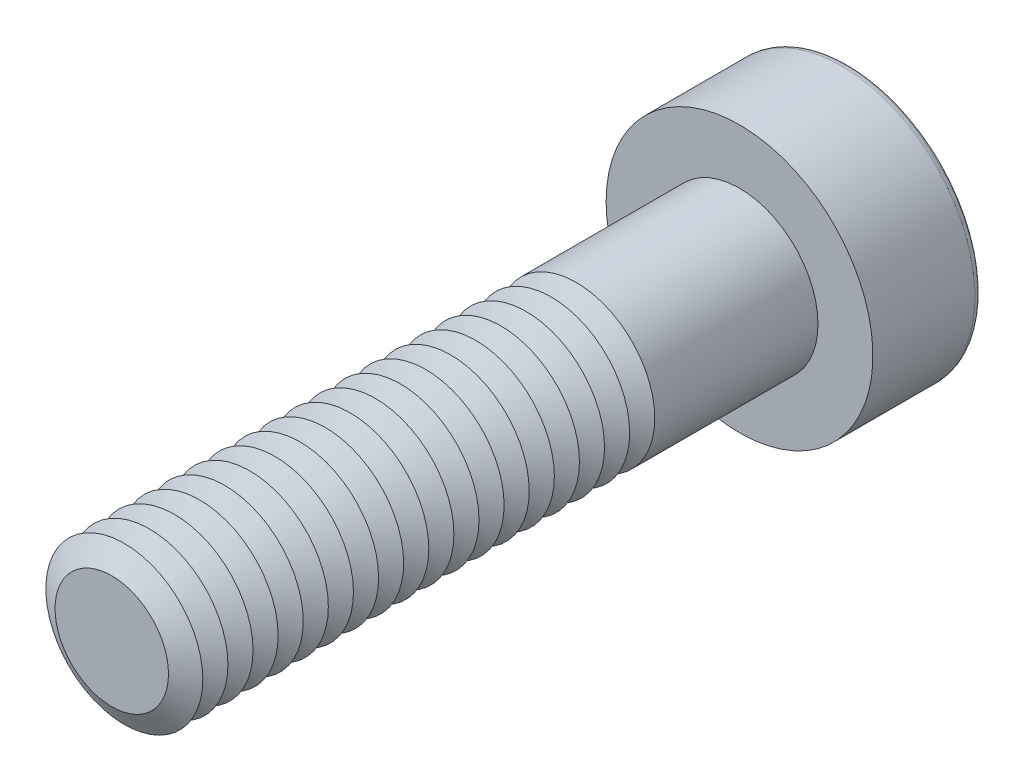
SolidWorks part; units mm, degrees
ref_plane "Front Plane" through (0, 0, 0) normal (0, 0, 1) x (1, 0, 0)
ref_plane "Top Plane" through (0, 0, 0) normal (0, 1, 0) x (1, 0, 0)
ref_plane "Right Plane" through (0, 0, 0) normal (1, 0, 0) x (0, 0, -1)
sketch "Sketch1" plane through (0, 0, 0) normal (0, 0, 1) x (1, 0, 0)
  circle A0 centre (0, 0) radius 2.5
  dimension "D1" = 5
extrude "Boss-Extrude1" add sketch "Sketch1" along normal blind 20
sketch "Sketch2" plane through (0, 0, 0) normal (0, 0, -1) x (-1, 0, 0)
  circle A0 centre (0, 0) radius 4.25
  dimension "D1" = 8.5
extrude "Boss-Extrude2" add sketch "Sketch2" along normal blind 3.5
sketch "Sketch3" plane through (0, 0, -3.5) normal (0, 0, -1) x (-1, 0, 0)
  line L1 (-0.866, 1.5) -> (-1.7321, 0)
  line L2 (-1.7321, 0) -> (-0.866, -1.5)
  line L3 (-0.866, -1.5) -> (0.866, -1.5)
  line L4 (0.866, -1.5) -> (1.7321, 0)
  line L5 (1.7321, 0) -> (0.866, 1.5)
  line L6 (0.866, 1.5) -> (-0.866, 1.5)
  circle A0 centre (0, 0) radius 1.5 construction
  dimension "D1" = 3
extrude "Cut-Extrude1" cut sketch "Sketch3" against normal blind 2.25
fillet "Fillet1" radius 0.25 1 edges at (-4.25, 0, -3.5)
sketch "Sketch4" plane through (0, 0, -1.25) normal (0, 0, -1) x (-1, 0, 0)
  line L0 (0.866, -1.5) -> (1.7321, 0) construction
  circle A0 centre (0, 0) radius 1.5
extrude "Cut-Extrude2" cut sketch "Sketch4" against normal through all draft 60
sketch "Sketch5" plane through (0, 0, -3.5) normal (0, 0, -1) x (-1, 0, 0)
  circle A0 centre (0, 0) radius 1.7321
extrude "Cut-Extrude3" cut sketch "Sketch5" against normal through all draft 75
sketch "Sketch7" plane through (0, 0, 0) normal (1, 0, 0) x (0, 0, -1)
  line L25 (-20, 1.8072) -> (-19.6, 2.5)
  line L26 (-20, 2.5) -> (-20, -2.5) construction
  line L27 (-19.6, 2.5) -> (-20.4, 2.5)
  line L28 (-20.4, 2.5) -> (-20, 1.8072)
  line L29 (0, 2.5) -> (-20, 2.5) construction
  dimension "D1" = 0.8
revolve "Cut-Revolve1" cut sketch "Sketch7" angle 360 about axis through (0, 0, 20) along (0, 0, -1)
pattern_linear "LPattern1" count 19 spacing 0.8 along (0, 0, -1) of "Cut-Revolve1"
